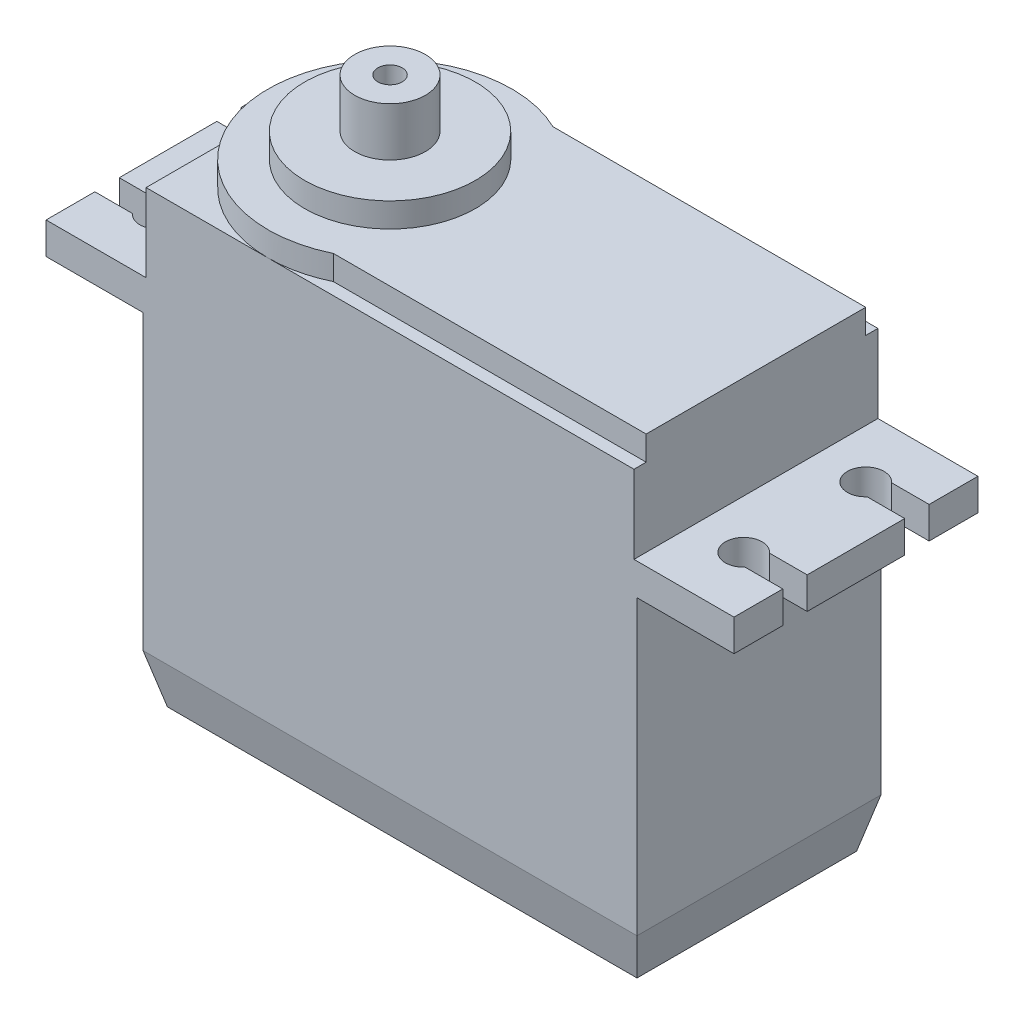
SolidWorks part; units mm, degrees
ref_plane "前视基准面" through (0, 0, 0) normal (0, 0, 1) x (1, 0, 0)
ref_plane "上视基准面" through (0, 0, 0) normal (0, 1, 0) x (1, 0, 0)
ref_plane "右视基准面" through (0, 0, 0) normal (1, 0, 0) x (0, 0, -1)
sketch "草图1" plane through (0, 0, 0) normal (0, 0, 1) x (1, 0, 0)
  line L1 (-20.25, 14) -> (20.25, 14)
  line L2 (-20.25, 14) -> (-20.25, -14)
  line L3 (-20.25, -14) -> (20.25, -14)
  line L4 (20.25, 14) -> (20.25, -14)
  line L5 (-20.25, 14) -> (20.25, -14) construction
  line L6 (-20.25, -14) -> (20.25, 14) construction
  point P0 (0, 0)
  dimension "D1" = 28
  dimension "D2" = 40.5
extrude "凸台-拉伸10" add sketch "草图1" along normal blind 20
sketch "草图18" plane through (0, 14, 0) normal (0, 1, 0) x (1, 0, 0)
  line L0 (20.25, 0) -> (-20.25, 0) construction
  line L1 (-20, 0) -> (20, 0)
  line L2 (-20, 0) -> (-20, -20)
  line L3 (-20, -20) -> (20, -20)
  line L4 (20, 0) -> (20, -20)
  line L5 (20.25, -20) -> (-20.25, -20) construction
  line L6 (-20.25, -20) -> (-20.25, 0) construction
  line L7 (20.25, -20) -> (20.25, 0) construction
  dimension "D1" = 0.25
  dimension "D2" = 0.25
extrude "凸台-拉伸11" add sketch "草图18" along normal blind 9
sketch "草图19" plane through (20, 0, 0) normal (1, 0, 0) x (0, 0, -1)
  line L0 (0, 23) -> (0, 14) construction
  line L1 (-20, 14) -> (0, 14)
  line L2 (-20, 14) -> (-20, 16.6)
  line L3 (-20, 16.6) -> (0, 16.6)
  line L4 (0, 14) -> (0, 16.6)
extrude "凸台-拉伸12" add sketch "草图19" along normal blind 8.2
sketch "草图20" plane through (0, 16.6, 0) normal (0, 1, 0) x (1, 0, 0)
  line L1 (20, 0) -> (20, -20) construction
  line L2 (28.2, 0) -> (28.2, -20) construction
  line L3 (28.2, -16) -> (25.118, -16)
  line L4 (28.2, -14) -> (25.118, -14)
  line L5 (28.2, -16) -> (28.2, -14)
  line L6 (24, -15) -> (23.2643, -15) construction
  line L7 (28.2, -4) -> (28.2, -6)
  line L8 (28.2, -4) -> (25.118, -4)
  line L9 (28.2, -6) -> (25.118, -6)
  arc A0 (25.118, -14) -> (25.118, -16) centre (24, -15) ccw
  arc A1 (25.118, -4) -> (25.118, -6) centre (24, -5) ccw
  dimension "D1" = 4
  dimension "D5" = 3
  dimension "D3" = 4
  dimension "D6" = 2
  dimension "D7" = 1
extrude "切除-拉伸6" cut sketch "草图20" against normal blind 8.2
mirror "镜向6" about plane through (0, 0, 0) normal (1, 0, 0) of "凸台-拉伸12"
mirror "镜向7" about plane through (0, 0, 0) normal (1, 0, 0) of "切除-拉伸6"
sketch "草图21" plane through (0, 23, 0) normal (0, 1, 0) x (1, 0, 0)
  line L0 (20, -20) -> (20, 0) construction
  line L1 (-20, -20) -> (20, -20) construction
  line L2 (20, -19) -> (-5.6411, -19)
  line L3 (20, -19) -> (20, -1)
  line L4 (20, -1) -> (-5.6411, -1)
  line L5 (20, 0) -> (-20, 0) construction
  arc A0 (-5.6411, -1) -> (-5.6411, -19) centre (-10, -10) ccw
  dimension "D1" = 30
  dimension "D2" = 10
  dimension "D3" = 1
  dimension "D4" = 1
extrude "凸台-拉伸13" add sketch "草图21" along normal blind 2
sketch "草图22" plane through (0, 25, 0) normal (0, 1, 0) x (1, 0, 0)
  circle A0 centre (-10, -10) radius 7
extrude "凸台-拉伸14" add sketch "草图22" along normal blind 2
sketch "草图23" plane through (0, 27, 0) normal (0, 1, 0) x (1, 0, 0)
  circle A0 centre (-10, -10) radius 2.9
  dimension "D1" = 5.8
extrude "凸台-拉伸15" add sketch "草图23" along normal blind 4
sketch "草图24" plane through (0, 31, 0) normal (0, 1, 0) x (1, 0, 0)
  circle A0 centre (-10, -10) radius 1
extrude "切除-拉伸7" cut sketch "草图24" against normal blind 4
chamfer "倒角1" distance 1 distance2 4 4 edges at (0, -14, 0) (0, -14, 20) (20.25, -14, 10) (-20.25, -14, 10)
